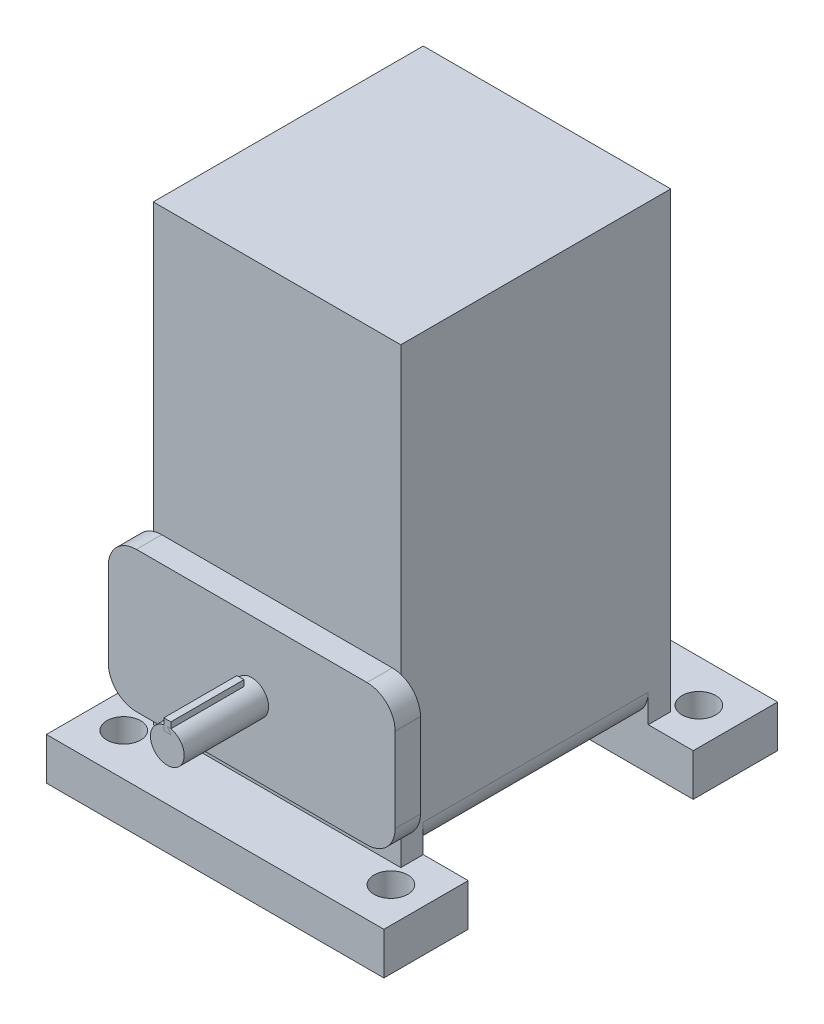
SolidWorks part; units mm, degrees
ref_plane "Front Plane" through (0, 0, 0) normal (0, 0, 1) x (1, 0, 0)
ref_plane "Top Plane" through (0, 0, 0) normal (0, 1, 0) x (1, 0, 0)
ref_plane "Right Plane" through (0, 0, 0) normal (1, 0, 0) x (0, 0, -1)
sketch "Sketch1" plane through (0, 0, 0) normal (0, 1, 0) x (1, 0, 0)
  line L1 (-44, -48) -> (44, -48)
  line L2 (-44, -48) -> (-44, 48)
  line L3 (-44, 48) -> (44, 48)
  line L4 (44, -48) -> (44, 48)
  line L5 (-44, -48) -> (44, 48) construction
  line L6 (-44, 48) -> (44, -48) construction
  point P0 (0, 0)
  dimension "D1" = 88
  dimension "D2" = 96
extrude "Boss-Extrude1" add sketch "Sketch1" along normal blind 161
sketch "Sketch3" plane through (0, 0, 48) normal (0, 0, 1) x (1, 0, 0)
  line L0 (-44, 0) -> (44, 0) construction
  line L1 (-51, 60) -> (51, 60)
  line L2 (-51, 60) -> (-51, 10)
  line L3 (-51, 10) -> (51, 10)
  line L4 (51, 60) -> (51, 10)
  line L5 (-51, 60) -> (51, 10) construction
  line L6 (-51, 10) -> (51, 60) construction
  point P0 (0, 35)
  point P8 (0, 0)
  dimension "D1" = 102
  dimension "D2" = 50
  dimension "D3" = 35
extrude "Boss-Extrude2" add sketch "Sketch3" along normal blind 9
fillet "Fillet1" radius 10 4 edges at (51, 10, 52.5) (51, 60, 52.5) (-51, 10, 52.5) (-51, 60, 52.5)
sketch "Sketch4" plane through (0, 0, 57) normal (0, 0, 1) x (1, 0, 0)
  line L0 (-44, 0) -> (44, 0) construction
  circle A0 centre (0, 35) radius 6
  dimension "D1" = 12
  dimension "D2" = 35
extrude "Boss-Extrude3" add sketch "Sketch4" along normal blind 30
sketch "Sketch5" plane through (0, 0, 87) normal (0, 0, 1) x (1, 0, 0)
  line L1 (-1.25, 39) -> (1.25, 39)
  line L2 (-1.25, 39) -> (-1.25, 43)
  line L3 (-1.25, 43) -> (1.25, 43)
  line L4 (1.25, 39) -> (1.25, 43)
  line L5 (-1.25, 39) -> (1.25, 43) construction
  line L6 (-1.25, 43) -> (1.25, 39) construction
  circle A0 centre (0, 35) radius 6 construction
  point P0 (0, 41)
  dimension "D1" = 4
  dimension "D2" = 2.5
extrude "Boss-Extrude4" add sketch "Sketch5" against normal blind 26 separate body
sketch "Sketch6" plane through (-44, 0, 0) normal (-1, 0, 0) x (0, 0, 1)
  circle A0 centre (0, 100) radius 8.5
  dimension "D2" = 17
  dimension "D1" = 100
extrude "Boss-Extrude5" add sketch "Sketch6" along normal blind 28
sketch "Sketch7" plane through (-72, 0, 0) normal (-1, 0, 0) x (0, 0, 1)
  line L1 (-1.5, 106) -> (1.5, 106)
  line L2 (-1.5, 106) -> (-1.5, 111)
  line L3 (-1.5, 111) -> (1.5, 111)
  line L4 (1.5, 106) -> (1.5, 111)
  line L5 (-1.5, 106) -> (1.5, 111) construction
  line L6 (-1.5, 111) -> (1.5, 106) construction
  circle A0 centre (0, 100) radius 8.5 construction
  point P0 (0, 108.5)
  dimension "D1" = 5
  dimension "D2" = 3
extrude "Boss-Extrude6" add sketch "Sketch7" against normal blind 28 separate body
sketch "Sketch8" plane through (0, 0, 0) normal (0, -1, 0) x (1, 0, 0)
  line L1 (-60, 40) -> (60, 40)
  line L2 (-60, 40) -> (-60, 70)
  line L3 (-60, 70) -> (60, 70)
  line L4 (60, 40) -> (60, 70)
  line L5 (-60, 40) -> (60, 70) construction
  line L6 (-60, 70) -> (60, 40) construction
  line L7 (-60, -40) -> (60, -40)
  line L8 (-60, -40) -> (-60, -70)
  line L9 (-60, -70) -> (60, -70)
  line L10 (60, -40) -> (60, -70)
  line L11 (-60, -40) -> (60, -70) construction
  line L12 (-60, -70) -> (60, -40) construction
  point P0 (0, 55)
  point P5 (0, -55)
  dimension "D1" = 55
  dimension "D2" = 55
  dimension "D3" = 120
  dimension "D4" = 120
  dimension "D5" = 30
  dimension "D6" = 30
extrude "Boss-Extrude7" add sketch "Sketch8" along normal blind 15
sketch "Sketch9" plane through (0, 0, 0) normal (0, 1, 0) x (1, 0, 0)
  point P0 (-47.5, -55)
  point P1 (47.5, -55)
  point P2 (-47, 55)
  point P4 (47, 55)
  dimension "D1" = 95
  dimension "D2" = 47.5
  dimension "D3" = 47.5
  dimension "D4" = 55
  dimension "D5" = 55
  dimension "D6" = 47
  dimension "D7" = 94
  dimension "D8" = 47
  dimension "D9" = 55
  dimension "D10" = 55
hole_wizard "Ø12.0mm Dowel Slot1" positions "Sketch10" profile "Sketch11" size "Ø12.0" standard "ISO"
sketch "Sketch10" plane through (0, 0, 0) normal (0, 1, 0) x (1, 0, 0)
  point P0 (-47, 55)
  point P3 (47, 55)
  point P6 (-47.5, -55)
  point P9 (47.5, -55)
sketch "Sketch11" plane through (-47, 0, -55) normal (1, 0, 0) x (0, 0, 1)
  line L0 (0, 0) -> (0, 23.6052)
  line L1 (0, 23.6052) -> (6, 20)
  line L2 (6, 20) -> (6, 0)
  line L5 (6, 0) -> (0, 0)
  line L10 (0, 23.6052) -> (-6, 20) construction
  line L11 (0, -6.35) -> (0, 107.95) construction
  dimension "Hole Dia." = 12
  dimension "Hole Depth" = 20
  dimension "Drill Angle" = 118
fillet "Fillet2" radius 10 1 edges at (-44, 0, 0)
fillet "Fillet3" radius 10 1 edges at (44, 0, 0)
